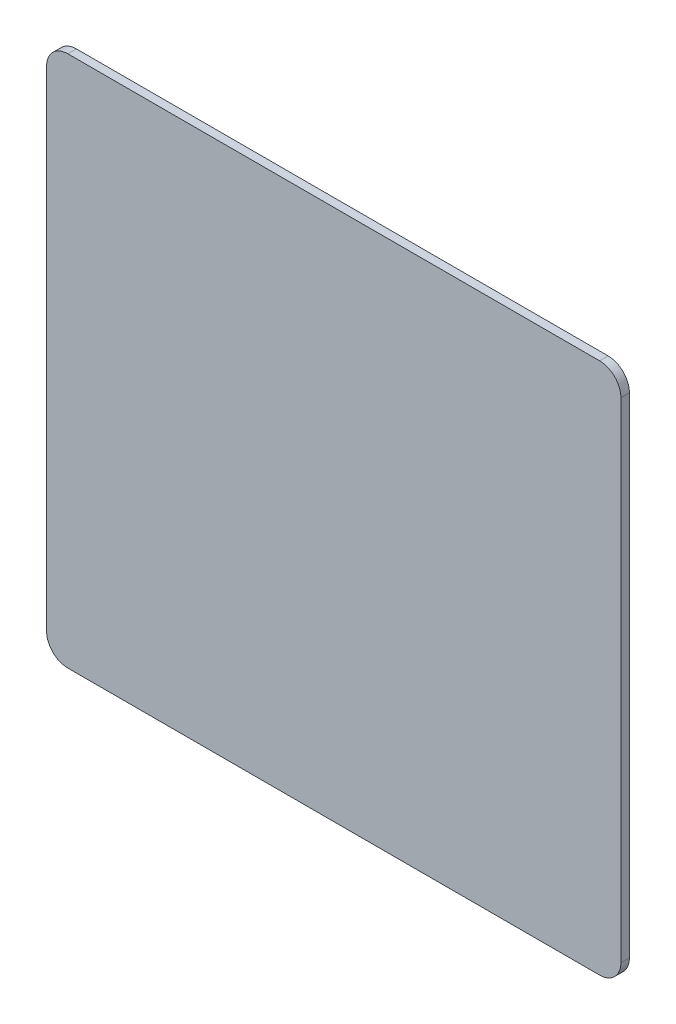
SolidWorks part; units mm, degrees
ref_plane "Front Plane" through (0, 0, 0) normal (0, 0, 1) x (1, 0, 0)
ref_plane "Top Plane" through (0, 0, 0) normal (0, 1, 0) x (1, 0, 0)
ref_plane "Right Plane" through (0, 0, 0) normal (1, 0, 0) x (0, 0, -1)
sketch "Sketch1" plane through (0, 0, 0) normal (0, 0, 1) x (1, 0, 0)
  line L1 (-107.95, -100) -> (107.95, -100)
  line L2 (-107.95, -100) -> (-107.95, 100)
  line L3 (-107.95, 100) -> (107.95, 100)
  line L4 (107.95, -100) -> (107.95, 100)
  line L5 (-107.95, -100) -> (107.95, 100) construction
  line L6 (-107.95, 100) -> (107.95, -100) construction
  point P0 (0, 0)
  dimension "D1" = 215.9
  dimension "D2" = 200
extrude "Boss-Extrude1" add sketch "Sketch1" along normal blind 3.2
fillet "Fillet1" radius 8 4 edges at (107.95, -100, 1.6) (107.95, 100, 1.6) (-107.95, 100, 1.6) (-107.95, -100, 1.6)
